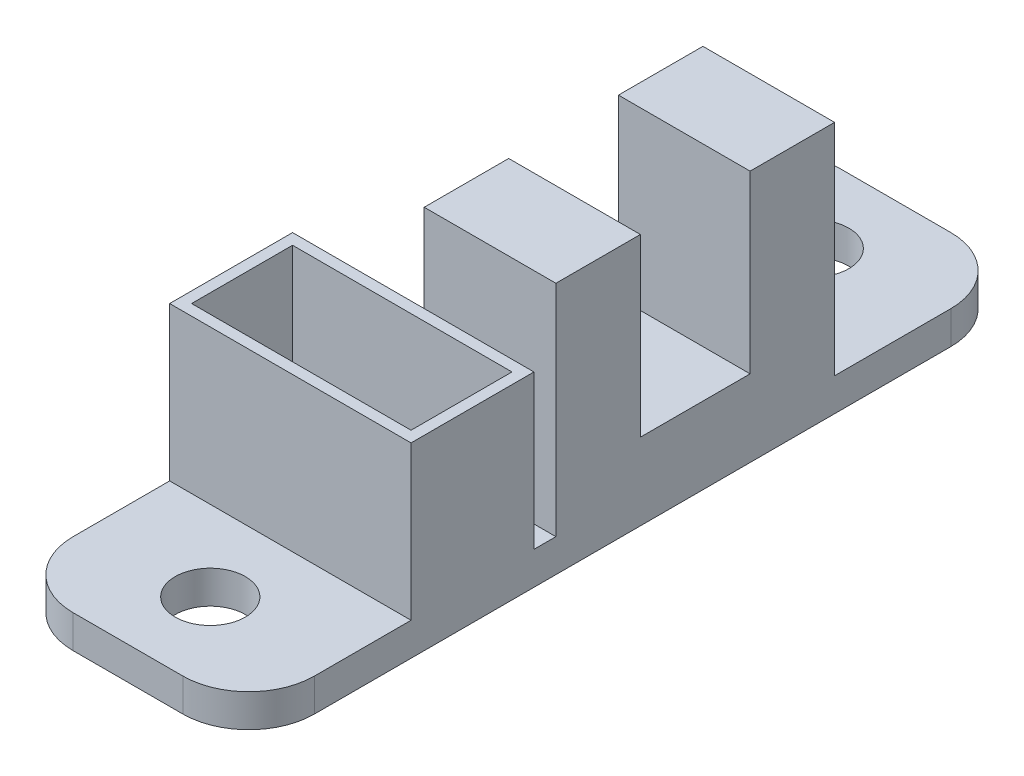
SolidWorks part; units mm, degrees
ref_plane "Спереди" through (0, 0, 0) normal (0, 0, 1) x (1, 0, 0)
ref_plane "Сверху" through (0, 0, 0) normal (0, 1, 0) x (1, 0, 0)
ref_plane "Справа" through (0, 0, 0) normal (1, 0, 0) x (0, 0, -1)
sketch "Эскиз1" plane through (0, 0, 0) normal (0, 1, 0) x (1, 0, 0)
  line L1 (-5.5, -17.5) -> (5.5, -17.5)
  line L2 (-5.5, -17.5) -> (-5.5, 17.5)
  line L3 (-5.5, 17.5) -> (5.5, 17.5)
  line L4 (5.5, -17.5) -> (5.5, 17.5)
  line L5 (-5.5, -17.5) -> (5.5, 17.5) construction
  line L6 (-5.5, 17.5) -> (5.5, -17.5) construction
  point P0 (0, 0)
  dimension "D1" = 11
  dimension "D2" = 35
extrude "Бобышка-Вытянуть1" add sketch "Эскиз1" along normal blind 1.5
sketch "Эскиз2" plane through (0, 1.5, 0) normal (0, 1, 0) x (1, 0, 0)
  line L0 (0, 0) -> (15.9526, 0) construction
  line L1 (0, 0) -> (0, 22.2255) construction
  circle A0 centre (0, 13.75) radius 1.6
  circle A1 centre (0, -13.75) radius 1.6
  dimension "D1" = 3.2
  dimension "D2" = 27.5
extrude "Вырез-Вытянуть1" cut sketch "Эскиз2" against normal blind 1.5
fillet "Скругление1" radius 3 4 edges at (5.5, 0.75, 17.5) (-5.5, 0.75, 17.5) (5.5, 0.75, -17.5) (-5.5, 0.75, -17.5)
sketch "Эскиз3" plane through (0, 1.5, 0) normal (0, 1, 0) x (1, 0, 0)
  line L0 (5.5, -14.5) -> (5.5, 14.5) construction
  line L1 (5.5, 9.2) -> (-0.5, 9.2)
  line L2 (5.5, 9.2) -> (5.5, -3.5)
  line L3 (5.5, -3.5) -> (-0.5, -3.5)
  line L4 (-0.5, 9.2) -> (-0.5, -3.5)
  line L5 (2.5, 17.5) -> (-2.5, 17.5) construction
  dimension "D1" = 6
  dimension "D2" = 12.7
  dimension "D3" = 21
extrude "Бобышка-Вытянуть2" add sketch "Эскиз3" along normal blind 10
sketch "Эскиз4" plane through (0, 11.5, 0) normal (0, 1, 0) x (1, 0, 0)
  line L0 (-0.5, 2.85) -> (5.5, 2.85) construction
  line L1 (-0.5, 9.2) -> (-0.5, -3.5) construction
  line L2 (5.5, -3.5) -> (5.5, 9.2) construction
  line L4 (-0.5, 0.35) -> (5.5, 0.35)
  line L5 (-0.5, 0.35) -> (-0.5, 5.35)
  line L6 (-0.5, 5.35) -> (5.5, 5.35)
  line L7 (5.5, 0.35) -> (5.5, 5.35)
  line L8 (-0.5, 0.35) -> (5.5, 5.35) construction
  line L9 (-0.5, 5.35) -> (5.5, 0.35) construction
  point P6 (2.5, 2.85)
  dimension "D1" = 5
extrude "Вырез-Вытянуть2" cut sketch "Эскиз4" against normal blind 8
sketch "Эскиз5" plane through (0, 1.5, 0) normal (0, 1, 0) x (1, 0, 0)
  line L0 (-5.5, 14.5) -> (-5.5, -14.5) construction
  line L1 (-5.5, -4.5) -> (5.5, -4.5)
  line L2 (-5.5, -4.5) -> (-5.5, -10.1)
  line L3 (-5.5, -10.1) -> (5.5, -10.1)
  line L4 (5.5, -4.5) -> (5.5, -10.1)
  line L6 (-0.5, -3.5) -> (5.5, -3.5) construction
  line L7 (5.5, 9.2) -> (5.5, 14.5) construction
  dimension "D1" = 1
  dimension "D2" = 5.6
extrude "Бобышка-Вытянуть3" add sketch "Эскиз5" along normal blind 7
sketch "Эскиз6" plane through (0, 8.5, 0) normal (0, 1, 0) x (1, 0, 0)
  line L0 (5.5, -4.5) -> (-5.5, -4.5) construction
  line L1 (-5, -5) -> (5, -5)
  line L2 (-5, -5) -> (-5, -9.6)
  line L3 (-5, -9.6) -> (5, -9.6)
  line L4 (5, -5) -> (5, -9.6)
  line L5 (-5.5, -10.1) -> (5.5, -10.1) construction
  line L6 (-5.5, -4.5) -> (-5.5, -10.1) construction
  line L7 (5.5, -10.1) -> (5.5, -4.5) construction
  dimension "D1" = 0.5
  dimension "D2" = 0.5
  dimension "D3" = 0.5
  dimension "D4" = 0.5
extrude "Вырез-Вытянуть3" cut sketch "Эскиз6" against normal blind 5
